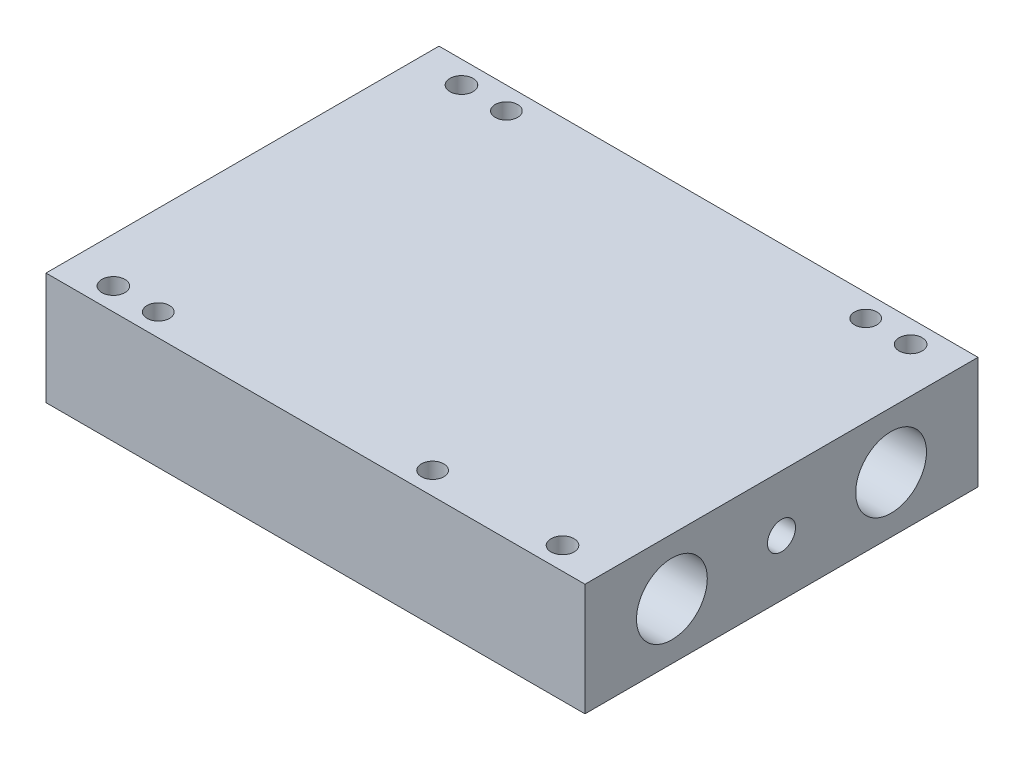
SolidWorks part; units mm, degrees
ref_plane "Front Plane" through (0, 0, 0) normal (0, 0, 1) x (1, 0, 0)
ref_plane "Top Plane" through (0, 0, 0) normal (0, 1, 0) x (1, 0, 0)
ref_plane "Right Plane" through (0, 0, 0) normal (1, 0, 0) x (0, 0, -1)
sketch "Sketch1" plane through (0, 0, 0) normal (1, 0, 0) x (0, 0, -1)
  line L0 (-55.5625, 15.875) -> (-55.5625, -15.875)
  line L1 (-55.5625, -15.875) -> (55.5625, -15.875)
  line L2 (55.5625, -15.875) -> (55.5625, 15.875)
  line L3 (55.5625, 15.875) -> (-55.5625, 15.875)
  line L4 (-55.5625, 15.875) -> (55.5625, -15.875) construction
  dimension "D1" = 111.125
  dimension "D2" = 31.75
extrude "Extrude1" add sketch "Sketch1" along normal mid plane 152.4
hole_wizard "5/16-18 Tapped Hole1" positions "Sketch3" profile "Sketch2" tap size "5/16-18" standard "ANSI Inch"
sketch "Sketch3" plane through (0, 15.875, 0) normal (0, 1, 0) x (1, 0, 0)
  point P0 (-63.5, 49.2125)
  point P2 (63.5, 49.2125)
  point P4 (63.5, -49.2125)
  point P6 (-63.5, -49.2125)
  point P14 (-133.1714, 44.11)
  dimension "D1" = 98.425
  dimension "D2" = 49.2125
  dimension "D3" = 127
  dimension "D4" = 63.5
sketch "Sketch2" plane through (-63.5, 15.875, -49.2125) normal (1, 0, 0) x (0, 0, 1)
  line L0 (0, 0) -> (0, 21.7223)
  line L1 (0, 21.7223) -> (3.2639, 19.7612)
  line L2 (3.2639, 19.7612) -> (3.2639, 0)
  line L5 (3.2639, 0) -> (0, 0)
  line L10 (0, 21.7223) -> (-3.2639, 19.7612) construction
  line L11 (0, -6.35) -> (0, 107.95) construction
  dimension "Tap Drill Dia." = 6.5278
  dimension "Tap Drill Depth" = 19.7612
  dimension "Drill Angle" = 118
hole_wizard "Hole1" positions "Sketch5" profile "Sketch4" legacy
sketch "Sketch5" plane through (0, 15.875, 0) normal (0, 1, 0) x (1, 0, 0)
  line L0 (-50.8, 49.2125) -> (-50.8, -49.2125) construction
  point P0 (-50.8, 49.2125)
  point P2 (-50.8, -49.2125)
  point P10 (50.8, 49.2125)
  point P12 (26.7629, -49.2125)
  point P17 (-50.8, 0)
  dimension "D1" = 98.425
  dimension "D2" = 101.6
  dimension "D3" = 50.8
sketch "Sketch4" plane through (-50.8, 15.875, -49.2125) normal (1, 0, 0) x (0, 0, 1)
  line L0 (0, 0) -> (0, 31.75)
  line L1 (0, 31.75) -> (3.175, 31.75)
  line L2 (3.175, 31.75) -> (3.175, 0)
  line L3 (3.175, 0) -> (0, 0)
  line L4 (0, 110) -> (0, -10) construction
  dimension "Diameter" = 6.35
  dimension "Depth" = 31.75
sketch "Sketch7" plane through (76.2, 0, 0) normal (1, 0, 0) x (0, 0, -1)
  line L0 (-30.988, 0) -> (30.988, 0) construction
  circle A0 centre (-30.988, 0) radius 10.0076
  circle A1 centre (30.988, 0) radius 10.0076
  circle A2 centre (0, 0) radius 3.9688
  dimension "D1" = 61.976
  dimension "D2" = 20.0152
  dimension "D3" = 7.9375
extrude "Cut-Extrude1" cut sketch "Sketch7" against normal through all
